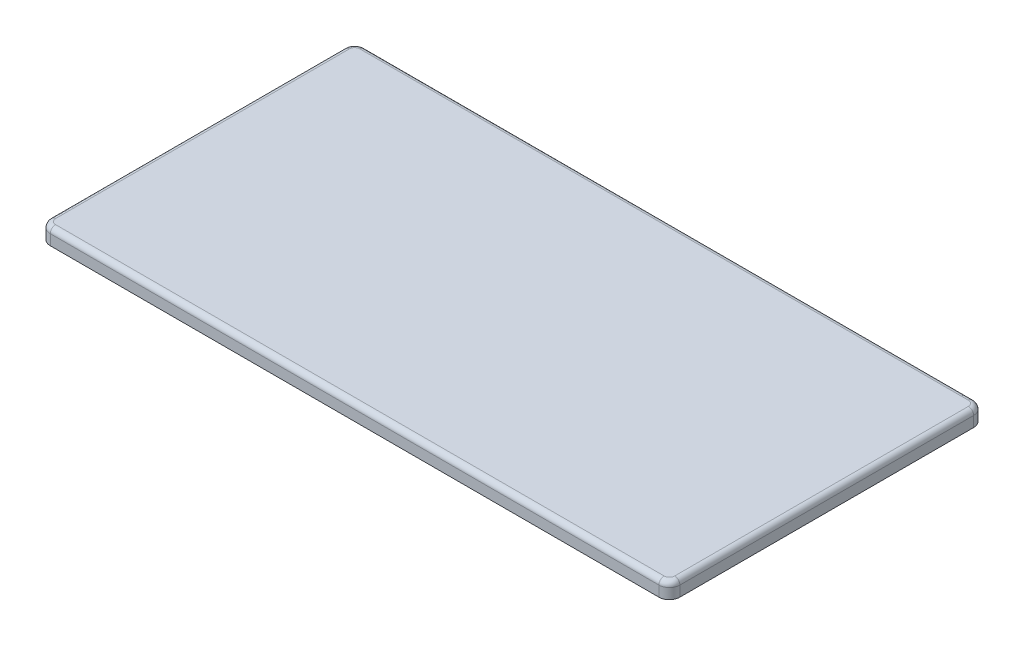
SolidWorks part; units mm, degrees
ref_plane "正面" through (0, 0, 0) normal (0, 0, 1) x (1, 0, 0)
ref_plane "平面" through (0, 0, 0) normal (0, 1, 0) x (1, 0, 0)
ref_plane "右側面" through (0, 0, 0) normal (1, 0, 0) x (0, 0, -1)
sketch "ｽｹｯﾁ1" plane through (0, 0, 0) normal (0, 1, 0) x (0, 0, -1)
  line L1 (-28, 60) -> (28, 60)
  line L2 (-30, 58) -> (-30, -58)
  line L3 (-28, -60) -> (28, -60)
  line L4 (30, 58) -> (30, -58)
  arc A0 (30, 58) -> (28, 60) centre (28, 58) ccw
  arc A1 (28, -60) -> (30, -58) centre (28, -58) ccw
  arc A2 (-30, -58) -> (-28, -60) centre (-28, -58) ccw
  arc A3 (-28, 60) -> (-30, 58) centre (-28, 58) ccw
  point P7 (30, 60)
  point P10 (30, -60)
  point P15 (-30, 60)
  dimension "D5" = 2
  dimension "D1" = 30
  dimension "D2" = 60
  dimension "D3" = 60
  dimension "D4" = 120
extrude "押し出し1" add sketch "ｽｹｯﾁ1" along normal mid plane 3
fillet "ﾌｨﾚｯﾄ1" radius 1 8 edges at (-59.4142, 1.5, 29.4142) (-60, 1.5, 0) (-59.4142, 1.5, -29.4142) (0, 1.5, -30) (59.4142, 1.5, -29.4142) (60, 1.5, 0) (59.4142, 1.5, 29.4142) (0, 1.5, 30)
sketch "ｽｹｯﾁ2" plane through (0, -1.5, 0) normal (0, -1, 0) x (1, 0, 0)
  line L1 (-58, 28.2) -> (58, 28.2)
  line L2 (-58.2, 28) -> (-58.2, -28)
  line L3 (-58, -28.2) -> (58, -28.2)
  line L4 (58.2, 28) -> (58.2, -28)
  arc A0 (-58, 28.2) -> (-58.2, 28) centre (-58, 28) ccw
  arc A1 (58.2, 28) -> (58, 28.2) centre (58, 28) ccw
  arc A2 (58, -28.2) -> (58.2, -28) centre (58, -28) ccw
  arc A3 (-58.2, -28) -> (-58, -28.2) centre (-58, -28) ccw
  point P7 (-58.2, 28.2)
  point P10 (58.2, 28.2)
  point P13 (58.2, -28.2)
  dimension "D5" = 0.2
  dimension "D1" = 58.2
  dimension "D2" = 116.4
  dimension "D3" = 28.2
  dimension "D4" = 56.4
extrude "押し出し2" cut sketch "ｽｹｯﾁ2" against normal blind 1
sketch "ｽｹｯﾁ4" plane through (0, -0.5, 0) normal (0, -1, 0) x (1, 0, 0)
  line L0 (-60, -28) -> (-60, 28) construction
  line L1 (-47.45, 17.45) -> (-42.55, 17.45)
  line L2 (-47.45, 17.45) -> (-47.45, 14.25)
  line L3 (-47.45, 14.25) -> (-42.55, 14.25)
  line L4 (-42.55, 17.45) -> (-42.55, 14.25)
  line L5 (60, 28) -> (60, -28) construction
  line L6 (42.55, 14.25) -> (47.45, 14.25)
  line L7 (42.55, 14.25) -> (42.55, 17.45)
  line L8 (42.55, 17.45) -> (47.45, 17.45)
  line L9 (47.45, 14.25) -> (47.45, 17.45)
  line L10 (-47.45, 17.45) -> (-42.55, 14.25) construction
  line L11 (-47.45, 14.25) -> (-42.55, 17.45) construction
  line L12 (42.55, 17.45) -> (47.45, 14.25) construction
  line L13 (42.55, 14.25) -> (47.45, 17.45) construction
  line L14 (-47.45, -14.25) -> (-42.55, -17.45) construction
  line L15 (-47.45, -14.25) -> (-42.55, -14.25)
  line L16 (-47.45, -14.25) -> (-47.45, -17.45)
  line L17 (-47.45, -17.45) -> (-42.55, -17.45)
  line L18 (-42.55, -14.25) -> (-42.55, -17.45)
  line L19 (42.55, -14.25) -> (47.45, -14.25)
  line L20 (42.55, -14.25) -> (42.55, -17.45)
  line L21 (42.55, -17.45) -> (47.45, -17.45)
  line L22 (47.45, -14.25) -> (47.45, -17.45)
  line L23 (-47.45, -17.45) -> (-42.55, -14.25) construction
  line L24 (42.55, -14.25) -> (47.45, -17.45) construction
  line L25 (42.55, -17.45) -> (47.45, -14.25) construction
  line L26 (-17.45, 17.45) -> (-12.55, 14.25) construction
  line L27 (-17.45, 17.45) -> (-12.55, 17.45)
  line L28 (-17.45, 17.45) -> (-17.45, 14.25)
  line L29 (-17.45, 14.25) -> (-12.55, 14.25)
  line L30 (-12.55, 17.45) -> (-12.55, 14.25)
  line L31 (-17.45, -14.25) -> (-12.55, -14.25)
  line L32 (-17.45, -14.25) -> (-17.45, -17.45)
  line L33 (-17.45, -17.45) -> (-12.55, -17.45)
  line L34 (-12.55, -14.25) -> (-12.55, -17.45)
  line L35 (-12.55, 17.45) -> (-17.45, 14.25) construction
  line L36 (-17.45, -14.25) -> (-12.55, -17.45) construction
  line L37 (-12.55, -14.25) -> (-17.45, -17.45) construction
  line L38 (12.55, 17.45) -> (17.45, 14.25) construction
  line L39 (12.55, 14.25) -> (17.45, 14.25)
  line L40 (12.55, 14.25) -> (12.55, 17.45)
  line L41 (12.55, 17.45) -> (17.45, 17.45)
  line L42 (17.45, 14.25) -> (17.45, 17.45)
  line L43 (12.55, -17.45) -> (17.45, -17.45)
  line L44 (12.55, -17.45) -> (12.55, -14.25)
  line L45 (12.55, -14.25) -> (17.45, -14.25)
  line L46 (17.45, -17.45) -> (17.45, -14.25)
  line L48 (12.55, 14.25) -> (17.45, 17.45) construction
  line L49 (12.55, -17.45) -> (17.45, -14.25) construction
  line L50 (12.55, -14.25) -> (17.45, -17.45) construction
  point P21 (45, 15.85)
  point P22 (45, -15.85)
  point P31 (-45, 15.85)
  point P32 (-15, 15.85)
  point P33 (45, 15.85)
  point P42 (15, 15.85)
  dimension "D1" = 4.9
  dimension "D2" = 3.2
  dimension "D3" = 12.55
  dimension "D4" = 17.45
  dimension "D5" = 4.9
  dimension "D6" = 17.45
  dimension "D7" = 3.2
  dimension "D8" = 12.55
  dimension "D9" = 3.2
  dimension "D10" = 17.45
  dimension "D11" = 4.9
  dimension "D12" = 25.1
  dimension "D13" = 4.9
  dimension "D14" = 25.1
extrude "押し出し4" add sketch "ｽｹｯﾁ4" along normal blind 8 draft 0.6
fillet "ﾌｨﾚｯﾄ2" radius 0.8 32 edges at (-45, -8.5, 17.3662) (-42.6338, -8.5, 15.85) (-45, -8.5, 14.3338) (-47.3662, -8.5, 15.85) (45, -8.5, 17.3662) (47.3662, -8.5, 15.85) (45, -8.5, 14.3338) (42.6338, -8.5, 15.85) (45, -8.5, -14.3338) (47.3662, -8.5, -15.85) (45, -8.5, -17.3662) (42.6338, -8.5, -15.85) (-45, -8.5, -14.3338) (-42.6338, -8.5, -15.85) (-45, -8.5, -17.3662) (-47.3662, -8.5, -15.85) (-15, -8.5, -14.3338) (-12.6338, -8.5, -15.85) (-15, -8.5, -17.3662) (-17.3662, -8.5, -15.85) (-15, -8.5, 17.3662) (-12.6338, -8.5, 15.85) (-15, -8.5, 14.3338) (-17.3662, -8.5, 15.85) (15, -8.5, -14.3338) (17.3662, -8.5, -15.85) (15, -8.5, -17.3662) (12.6338, -8.5, -15.85) (15, -8.5, 17.3662) (17.3662, -8.5, 15.85) (15, -8.5, 14.3338) (12.6338, -8.5, 15.85)
